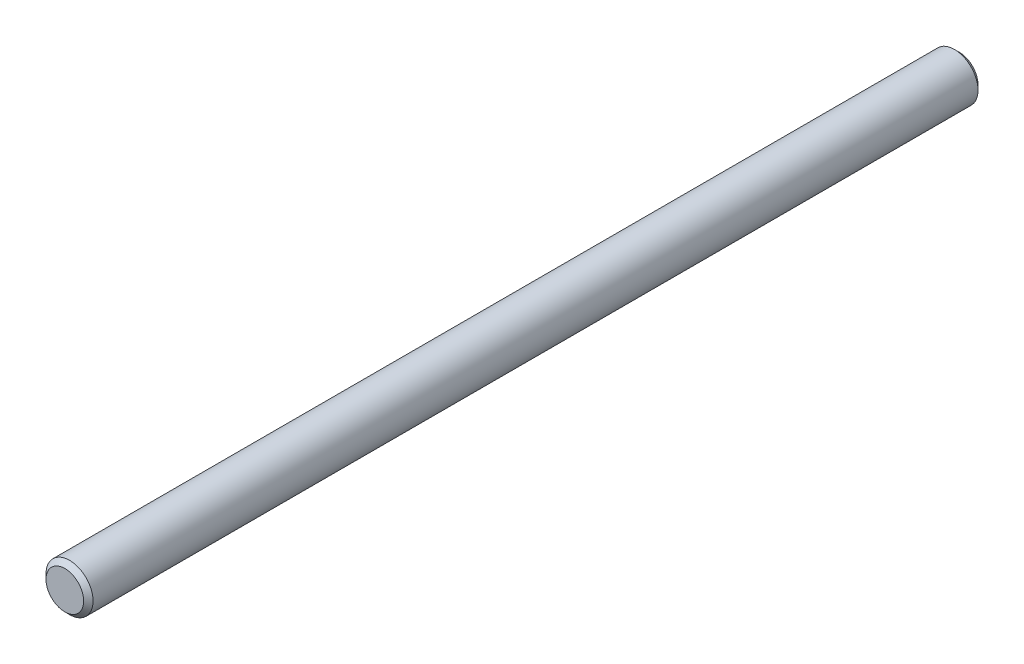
SolidWorks part; units mm, degrees
ref_plane "Plan de face" through (0, 0, 0) normal (0, 0, 1) x (1, 0, 0)
ref_plane "Plan de dessus" through (0, 0, 0) normal (0, 1, 0) x (1, 0, 0)
ref_plane "Plan de droite" through (0, 0, 0) normal (1, 0, 0) x (0, 0, -1)
sketch "Esquisse1" plane through (0, 0, 0) normal (0, 0, 1) x (1, 0, 0)
  circle A0 centre (0, 0) radius 1.5
extrude "Extrusion1" add sketch "Esquisse1" along normal blind 57
chamfer "Chanfrein1" distance 0.3 angle 45 2 edges at (1.5, 0, 0) (1.5, 0, 57)
